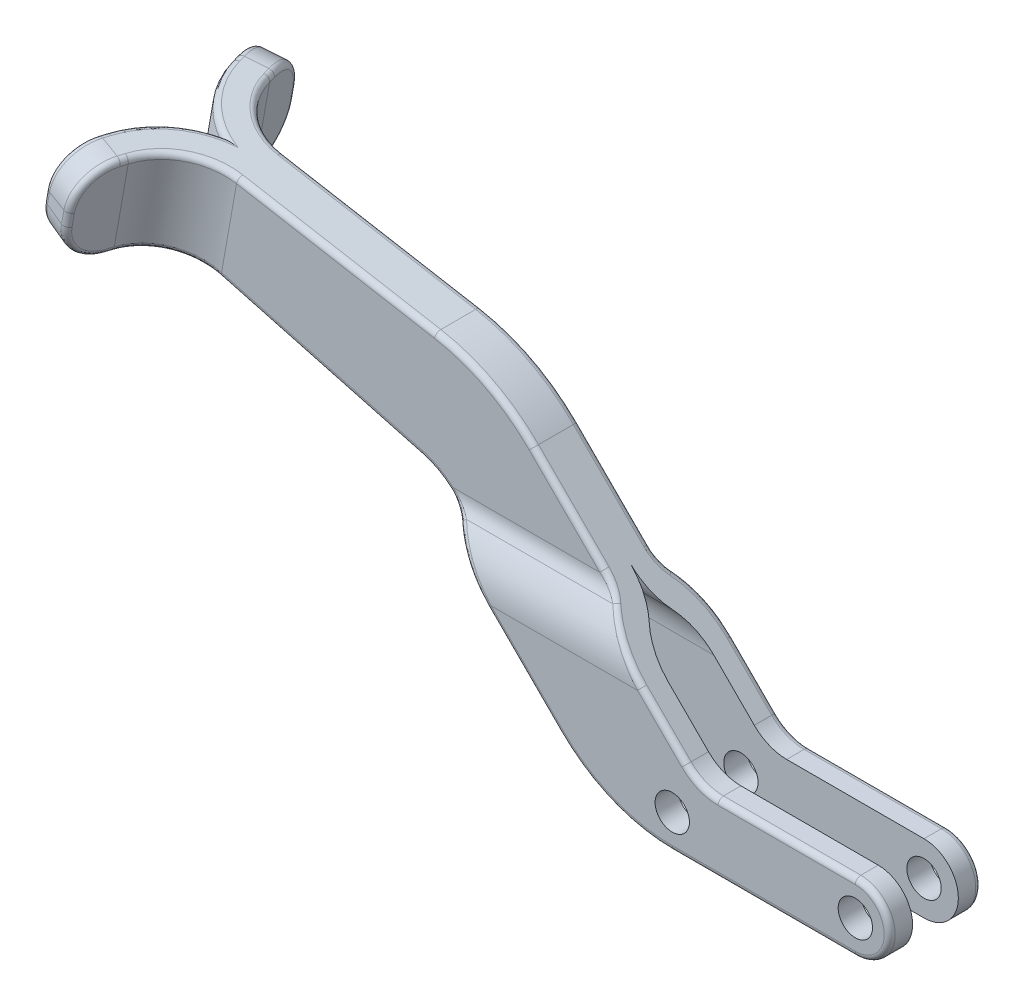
SolidWorks part; units mm, degrees
ref_plane "front" through (0, 0, 0) normal (0, 0, 1) x (1, 0, 0)
ref_plane "top" through (0, 0, 0) normal (0, 1, 0) x (1, 0, 0)
ref_plane "side" through (0, 0, 0) normal (1, 0, 0) x (0, 0, -1)
sketch "Sketch1" plane through (0, 0, 0) normal (0, 0, 1) x (1, 0, 0)
  line L0 (0, 4.7625) -> (-19.05, 4.7625)
  line L1 (0, -4.7625) -> (-25.4, -4.7625)
  line L2 (-23.5401, 6.6224) -> (-47.8835, 30.9658)
  line L3 (-59.1089, 19.7405) -> (-41.1154, 1.7471)
  line L4 (-63.3788, 22.2057) -> (-91.2266, 29.6675)
  line L5 (-61.4334, 38.0194) -> (-88.9, 42.8625)
  line L6 (-91.2266, 29.6675) -> (-88.9, 42.8625)
  arc A0 (0, 4.7625) -> (0, -4.7625) centre (0, 0) cw
  arc A1 (-25.4, -4.7625) -> (-41.1154, 1.7471) centre (-25.4, 17.4625) cw
  arc A2 (-23.5401, 6.6224) -> (-19.05, 4.7625) centre (-19.05, 11.1125) ccw
  arc A3 (-59.1089, 19.7405) -> (-63.3788, 22.2057) centre (-65.8441, 13.0053) ccw
  arc A4 (-47.8835, 30.9658) -> (-61.4334, 38.0194) centre (-65.8441, 13.0053) ccw
  dimension "D6" = 22.225
  dimension "D7" = 6.35
  dimension "D10" = 25.4
  dimension "D8" = 25.4
  dimension "D1" = 15
  dimension "D2" = 9.525
  dimension "D3" = 15.875
  dimension "D4" = 5
  dimension "D5" = 135
  dimension "D9" = 88.9
  dimension "D11" = 47.625
extrude "Base-Extrude" add sketch "Sketch1" along normal mid plane 12.7
sketch "Sketch2" plane through (0, 0, 0) normal (1, 0, 0) x (0, 0, -1)
  line L0 (0, 0) -> (0, 30.3525) construction
  line L1 (-3.175, -4.7625) -> (-3.175, 12.2372)
  line L2 (-6.35, -4.7625) -> (6.35, -4.7625) construction
  line L3 (3.175, -4.7625) -> (3.175, 12.2372)
  line L4 (-3.175, -4.7625) -> (3.175, -4.7625)
  line L5 (-6.35, 4.7625) -> (-6.35, -4.7625) construction
  arc A0 (-3.175, 12.2372) -> (-1.5875, 16.4374) centre (3.175, 12.2372) cw
  arc A1 (3.175, 12.2372) -> (1.5875, 16.4374) centre (-3.175, 12.2372) ccw
  arc A2 (-1.5875, 16.4374) -> (0, 20.6375) centre (-6.35, 20.6375) ccw
  arc A3 (1.5875, 16.4374) -> (0, 20.6375) centre (6.35, 20.6375) cw
  dimension "D1" = 6.35
  dimension "D2" = 6.35
  dimension "D3" = 3.175
  dimension "D4" = 25.4
extrude "Cut-Extrude1" cut sketch "Sketch2" against normal through all and the other way through all
sketch "Sketch3" plane through (0, 0, 0) normal (1, 0, 0) x (0, 0, -1)
  line L0 (-6.35, 6.6224) -> (-6.35, 30.9658) construction
  line L1 (-3.175, 20.6375) -> (-3.175, 42.8625)
  line L2 (-6.35, 42.8625) -> (6.35, 42.8625) construction
  line L3 (-3.175, 42.8625) -> (-6.35, 42.8625)
  line L4 (-6.35, 42.8625) -> (-6.35, 12.2372)
  line L7 (0, 20.6375) -> (0, 42.0866) construction
  arc A0 (-1.5875, 16.4374) -> (0, 20.6375) centre (-6.35, 20.6375) ccw construction
  arc A1 (-3.175, 20.6375) -> (-3.9688, 18.5374) centre (-6.35, 20.6375) cw
  arc A2 (-3.9688, 18.5374) -> (-6.35, 12.2372) centre (3.175, 12.2372) ccw
  arc A3 (-1.5875, 16.4374) -> (-3.175, 12.2372) centre (3.175, 12.2372) ccw construction
extrude "Cut-Extrude2" cut sketch "Sketch3" against normal through all
mirror "Mirror1" about plane through (0, 0, 0) normal (0, 0, 1) of "Cut-Extrude2"
sketch "Sketch4" plane through (0, 0, 6.35) normal (0, 0, 1) x (1, 0, 0)
  line L0 (0, 0) -> (-25.4, 0) construction
  circle A0 centre (0, 0) radius 2.3813
  circle A1 centre (-25.4, 0) radius 2.3813
  dimension "D1" = 4.7625
  dimension "D2" = 25.4
extrude "Cut-Extrude3" cut sketch "Sketch4" against normal through all
sketch "Sketch6" plane through (4.6493, 26.3672, 0) normal (0.1736, 0.9848, 0) x (-0.9848, 0.1736, 0)
  line L0 (94.9924, -3.175) -> (94.9924, 1.1622)
  line L1 (94.9924, 1.1622) -> (116.7049, 1.1622) construction
  line L2 (94.9924, -3.175) -> (84.325, -3.175) construction
  line L3 (94.9924, -3.175) -> (67.1021, -3.175) construction
  line L4 (103.5124, -9.8082) -> (105.0472, -15.8756)
  line L5 (105.0472, -15.8756) -> (109.252, -14.812)
  line L6 (109.252, -14.812) -> (107.7172, -8.7446)
  line L7 (103.5124, -9.8082) -> (110.9122, -7.9364) construction
  arc A0 (94.9924, -3.175) -> (103.5124, -9.8082) centre (94.9924, -11.9634) cw
  arc A1 (107.7172, -8.7446) -> (94.9924, 1.1622) centre (94.9924, -11.9634) ccw
extrude "Boss-Extrude1" add sketch "Sketch6" along normal up to surface (13.3985 mm away)
mirror "Mirror2" about plane through (0, 0, 0) normal (0, 0, 1) of "Boss-Extrude1"
fillet "Fillet1" radius 5.334 4 edges at (-100.8725, 44.9736, -15.3438) (-103.0144, 32.8261, -15.3438) (-103.0144, 32.8261, 15.3438) (-100.8725, 44.9736, 15.3438)
fillet "Fillet2" radius 0.762 48 edges at (-33.9051, -3.0707, 6.35) (-21.48, 5.2459, -6.35) (-26.3476, 9.4298, -6.35) (-46.3605, 6.9921, -6.35) (-58.471, 19.1026, -3.5707) (-77.3027, 25.9366, -3.175) (-61.6875, 21.5755, -3.175) (-36.4327, 19.515, -3.3801) (-32.5226, 15.6048, -5.7348) (-54.9732, 15.6048, -5.7348) (-54.1156, 35.5354, -3.175) (-42.7194, 25.8016, -3.175) (-75.1667, 40.4409, -3.175) (-33.9051, -3.0707, -6.35) (-12.7, -4.7625, -6.35) (4.7625, 0, -6.35) (-94.2168, 43.8, -5.0288) (-97.4022, 44.3617, -10.2563) (-99.6112, 31.9142, -10.3116) (-96.4614, 31.0702, -5.0288) (-96.4614, 31.0702, 5.0288) (-99.6112, 31.9142, 10.3116) (-97.4022, 44.3617, 10.2563) (-94.2168, 43.8, 5.0288) (-99.8971, 38.3978, 15.8756) (-98.696, 43.0034, 14.361) (-100.3486, 33.6877, 14.3999) (-99.8971, 38.3978, -15.8756) (-100.3486, 33.6877, -14.3999) (-98.696, 43.0034, -14.361) (-26.3476, 9.4298, 6.35) (-21.48, 5.2459, 6.35) (-9.525, 4.7625, 6.35) (4.7625, 0, 6.35) (-12.7, -4.7625, 6.35) (-46.3605, 6.9921, 6.35) (-77.3027, 25.9366, 3.175) (-58.471, 19.1026, 3.5707) (-54.1156, 35.5354, 3.175) (-42.7194, 25.8016, 3.175) (-75.1667, 40.4409, 3.175) (-61.6875, 21.5755, 3.175) (-32.5226, 15.6048, 5.7348) (-36.4327, 19.515, 3.3801) (-54.9732, 15.6048, 5.7348) (-9.525, 4.7625, -6.35)
fillet "Fillet3" radius 0.762 14 edges at (-100.9829, 32.2817, 3.535) (-98.8091, 44.6097, 3.535) (-103.6883, 33.0066, 9.248) (-103.6883, 33.0066, -9.248) (-104.0061, 39.3091, 14.812) (-101.5431, 45.0918, 9.1927) (-102.8369, 43.7336, 13.2974) (-104.4257, 34.7801, 13.3363) (-101.5431, 45.0918, -9.1927) (-104.0061, 39.3091, -14.812) (-104.4257, 34.7801, -13.3363) (-102.8369, 43.7336, -13.2974)
